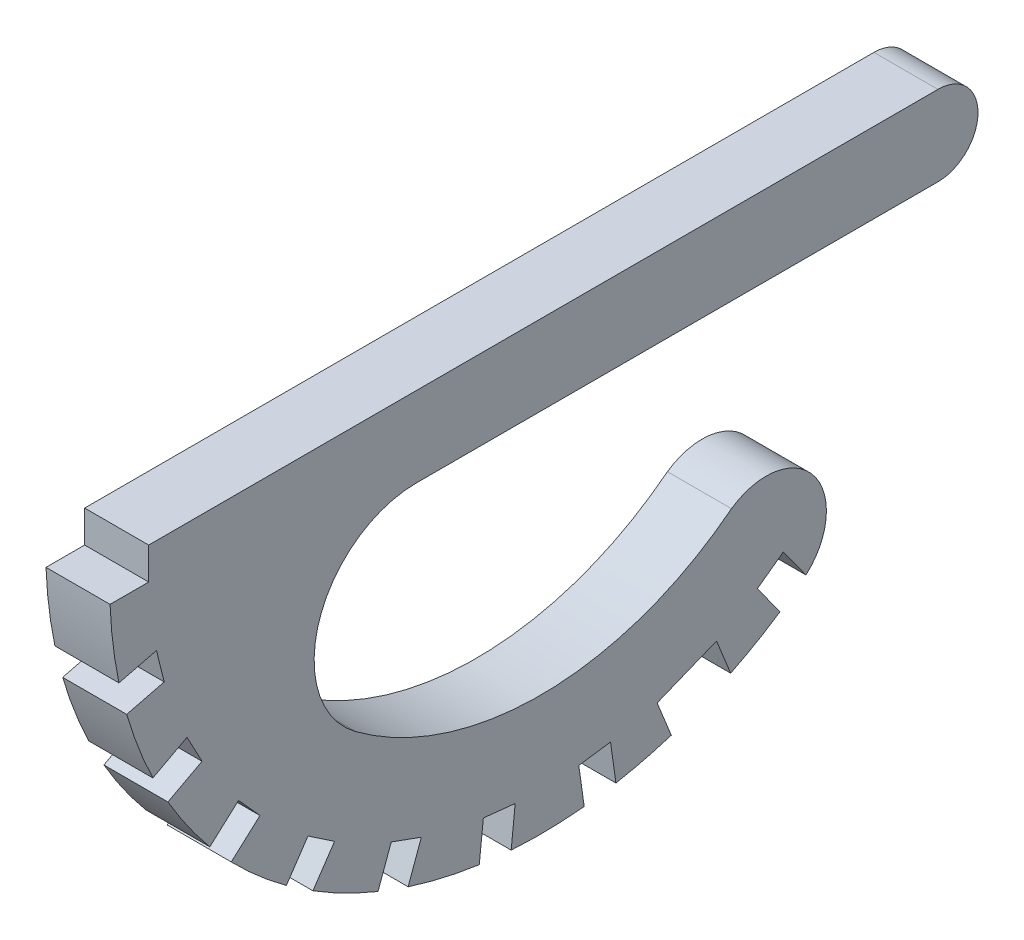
SolidWorks part; units mm, degrees
ref_plane "Спереди" through (0, 0, 0) normal (0, 0, 1) x (1, 0, 0)
ref_plane "Сверху" through (0, 0, 0) normal (0, 1, 0) x (1, 0, 0)
ref_plane "Справа" through (0, 0, 0) normal (1, 0, 0) x (0, 0, -1)
sketch "Эскиз1" plane through (0, 0, 0) normal (1, 0, 0) x (0, 0, -1)
  line L0 (-241.8808, -9) -> (-220, -9)
  line L1 (-220, 9) -> (223.5304, 9)
  line L2 (-220, -9) -> (-220, 9)
  line L3 (-241.8808, 9) -> (-220, 9)
  line L4 (223.5304, -36) -> (-69.4165, -36)
  line L5 (-236.8732, -49.7836) -> (-215.6424, -44.4902)
  line L6 (-211.2878, -61.9555) -> (-215.6424, -44.4902)
  line L7 (-232.5187, -67.2489) -> (-211.2878, -61.9555)
  line L8 (-217.7934, -105.6097) -> (-198.4737, -95.3372)
  line L9 (-190.0232, -111.2303) -> (-198.4737, -95.3372)
  line L10 (-209.3429, -121.5027) -> (-190.0232, -111.2303)
  line L11 (-185.7747, -155.1616) -> (-169.514, -140.5204)
  line L12 (-157.4697, -153.897) -> (-169.514, -140.5204)
  line L13 (-173.7303, -168.5382) -> (-157.4697, -153.897)
  line L14 (-142.7194, -195.4956) -> (-130.4838, -177.3555)
  line L15 (-115.5611, -187.421) -> (-130.4838, -177.3555)
  line L16 (-127.7967, -205.561) -> (-115.5611, -187.421)
  line L17 (-91.1854, -224.2155) -> (-83.7017, -203.6542)
  line L18 (-66.7872, -209.8106) -> (-83.7017, -203.6542)
  line L19 (-74.2709, -230.3718) -> (-66.7872, -209.8106)
  line L20 (-34.2341, -239.615) -> (-31.947, -217.8541)
  line L21 (-14.0456, -219.7356) -> (-31.947, -217.8541)
  line L22 (-16.3327, -241.4966) -> (-14.0456, -219.7356)
  line L23 (24.7509, -240.7794) -> (21.7057, -219.1115)
  line L24 (39.5305, -216.6064) -> (21.7057, -219.1115)
  line L25 (42.5757, -238.2743) -> (39.5305, -216.6064)
  line L26 (82.2655, -227.6395) -> (74.0688, -207.3519)
  line L27 (90.7581, -200.609) -> (74.0688, -207.3519)
  line L28 (98.9548, -220.8966) -> (90.7581, -200.609)
  line L29 (134.8928, -200.9758) -> (122.0316, -183.2738)
  line L30 (136.5939, -172.6937) -> (122.0316, -183.2738)
  line L31 (149.4551, -190.3956) -> (136.5939, -172.6937)
  line L32 (73.6696, -230.3891) -> (65.7241, -210.7234)
  line L33 (65.7241, -210.7234) -> (84.0414, -256.0602) construction
  line L34 (65.7241, -210.7234) -> (99.1028, -197.2375)
  line L35 (99.1028, -197.2375) -> (107.0482, -216.9033)
  line L36 (117.42, -242.5744) -> (99.1028, -197.2375) construction
  arc A0 (-241.7133, -9) -> (-236.7107, -49.7431) centre (0, 0) ccw
  arc A1 (-103.7376, -139.9172) -> (107.4951, -137.0515) centre (0, 0) ccw
  arc A2 (223.5304, -36) -> (223.5304, 9) centre (223.5304, -13.5) ccw
  arc A3 (-69.4165, -36) -> (-103.7376, -139.9172) centre (-69.4165, -93.6263) ccw
  arc A4 (107.4951, -137.0515) -> (149.2775, -190.3223) centre (126.9384, -164.8226) cw
  arc A5 (-232.3561, -67.2084) -> (-217.6455, -105.531) centre (0, 0) ccw
  arc A6 (-209.195, -121.4241) -> (-185.6502, -155.0495) centre (0, 0) ccw
  arc A7 (-173.6058, -168.4261) -> (-142.6257, -195.3567) centre (0, 0) ccw
  arc A8 (-127.7031, -205.4222) -> (-91.1281, -224.0581) centre (0, 0) ccw
  arc A9 (-74.2136, -230.2144) -> (-34.2166, -239.4485) centre (0, 0) ccw
  arc A10 (-16.3152, -241.33) -> (24.7276, -240.6136) centre (0, 0) ccw
  arc A11 (42.5524, -238.1085) -> (73.6696, -230.3891) centre (0, 0) ccw
  arc A12 (107.0482, -216.9033) -> (134.7944, -200.8403) centre (0, 0) ccw
  point P60 (0, 0)
  dimension "D1" = 45
  dimension "D2" = 57.6263
  dimension "D3" = 10
extrude "Бобышка-Вытянуть1" add sketch "Эскиз1" along normal blind 36 from offset 300 contours A4 A1 A3 L4 A2 L1 A0
